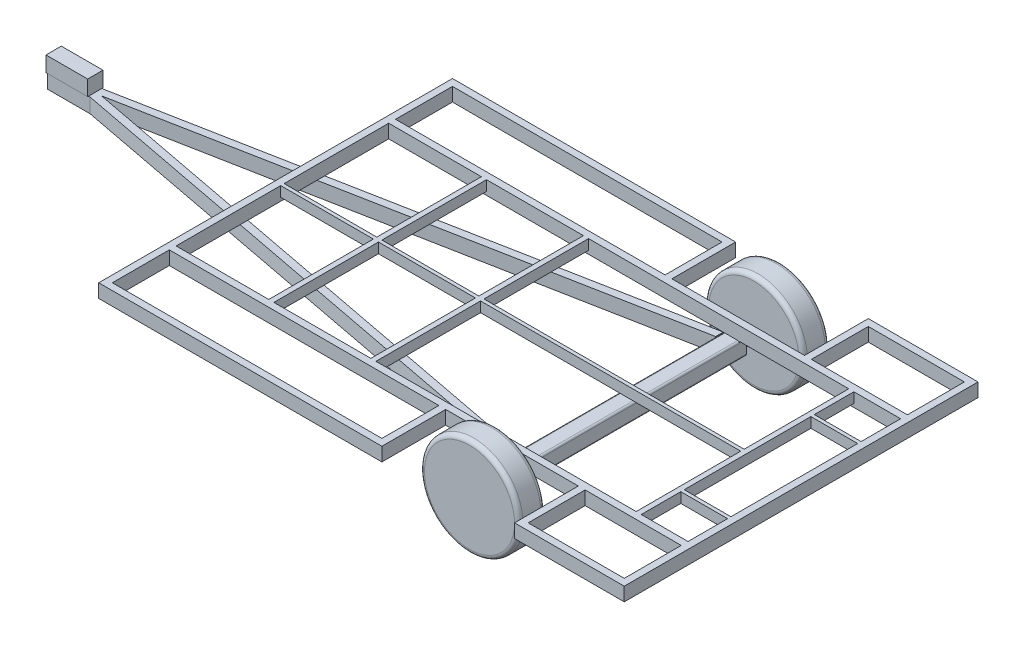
SolidWorks part; units mm, degrees
ref_plane "Plan de face" through (0, 0, 0) normal (0, 0, 1) x (1, 0, 0)
ref_plane "Plan de dessus" through (0, 0, 0) normal (0, 1, 0) x (1, 0, 0)
ref_plane "Plan de droite" through (0, 0, 0) normal (1, 0, 0) x (0, 0, -1)
sketch "Esquisse1" plane through (0, 0, 0) normal (0, 1, 0) x (1, 0, 0)
  line L1 (0, 0) -> (3090, 0)
  line L2 (0, 0) -> (0, 2080)
  line L3 (0, 2080) -> (3090, 2080)
  line L4 (3090, 0) -> (3090, 2080)
  line L5 (40, 2040) -> (3050, 2040)
  line L6 (40, 2040) -> (40, 40)
  line L7 (40, 40) -> (3050, 40)
  line L8 (3050, 2040) -> (3050, 40)
  dimension "D1" = 2080
  dimension "D2" = 3090
  dimension "D3" = 40
  dimension "D4" = 40
  dimension "D5" = 40
  dimension "D6" = 40
extrude "Boss.-Extru.1" add sketch "Esquisse1" along normal blind 80
sketch "Esquisse2" plane through (0, 0, 0) normal (0, 1, 0) x (1, 0, 0)
  line L0 (40, 2040) -> (40, 40) construction
  line L1 (40, 1665) -> (3050, 1665)
  line L2 (40, 1665) -> (40, 1705)
  line L3 (40, 1705) -> (3050, 1705)
  line L4 (3050, 1665) -> (3050, 1705)
  line L5 (3050, 40) -> (3050, 2040) construction
  line L6 (3050, 2040) -> (40, 2040) construction
  line L7 (40, 415) -> (3050, 415)
  line L8 (40, 415) -> (40, 375)
  line L9 (40, 375) -> (3050, 375)
  line L10 (3050, 415) -> (3050, 375)
  line L11 (1665, 2040) -> (1625, 2040)
  line L12 (1665, 2040) -> (1665, 1705)
  line L13 (1665, 1705) -> (1625, 1705)
  line L14 (1625, 2040) -> (1625, 1705)
  line L15 (40, 40) -> (3050, 40) construction
  line L16 (2445, 2040) -> (2485, 2040)
  line L17 (2445, 2040) -> (2445, 1705)
  line L18 (2445, 1705) -> (2485, 1705)
  line L19 (2485, 2040) -> (2485, 1705)
  line L20 (1625, 375) -> (1665, 375)
  line L21 (1625, 375) -> (1625, 40)
  line L22 (1625, 40) -> (1665, 40)
  line L23 (1665, 375) -> (1665, 40)
  line L25 (2445, 375) -> (2485, 375)
  line L26 (2445, 375) -> (2445, 40)
  line L27 (2445, 40) -> (2485, 40)
  line L28 (2485, 375) -> (2485, 40)
  dimension "D1" = 40
  dimension "D2" = 40
  dimension "D3" = 565
  dimension "D4" = 780
  dimension "D5" = 40
  dimension "D6" = 335
  dimension "D7" = 335
  dimension "D8" = 40
extrude "Boss.-Extru.7" add sketch "Esquisse2" along normal blind 80 contours L1 L4 L3 L2 | L12 L13 L14 L11 | L19 L18 L17 L16 | L23 L22 L21 L20 | L9 L10 L7 L8 | L26 L27 L28 L25
sketch "Esquisse4" plane through (0, 0, 0) normal (0, 1, 0) x (1, 0, 0)
  line L0 (40, 1050) -> (585, 1050)
  line L1 (40, 1665) -> (40, 415) construction
  line L2 (585, 1050) -> (585, 1665)
  line L3 (40, 1665) -> (3050, 1665) construction
  line L4 (585, 1665) -> (615, 1665)
  line L5 (615, 1665) -> (615, 1050)
  line L6 (615, 1050) -> (1185, 1050)
  line L7 (1185, 1050) -> (1185, 1665)
  line L8 (1185, 1665) -> (1215, 1665)
  line L9 (1215, 1665) -> (1215, 1050)
  line L10 (1215, 1050) -> (2745, 1050)
  line L11 (2745, 1050) -> (2745, 1665)
  line L12 (2745, 1665) -> (2775, 1665)
  line L13 (2775, 1665) -> (2775, 1432.5)
  line L14 (2775, 1432.5) -> (3050, 1432.5)
  line L15 (3050, 415) -> (3050, 1665) construction
  line L16 (3050, 1432.5) -> (3050, 1412.5)
  line L17 (3050, 1412.5) -> (2775, 1412.5)
  line L18 (2775, 1412.5) -> (2775, 667.5)
  line L20 (40, 1030) -> (40, 1050)
  line L21 (-422.2595, 1040) -> (3457.475, 1040) construction
  line L22 (2775, 415) -> (2775, 647.5)
  line L23 (2745, 415) -> (2775, 415)
  line L24 (2745, 1030) -> (2745, 415)
  line L25 (1215, 1030) -> (2745, 1030)
  line L26 (1215, 415) -> (1215, 1030)
  line L27 (1185, 415) -> (1215, 415)
  line L28 (1185, 1030) -> (1185, 415)
  line L29 (615, 1030) -> (1185, 1030)
  line L30 (615, 415) -> (615, 1030)
  line L31 (585, 415) -> (615, 415)
  line L32 (585, 1030) -> (585, 415)
  line L33 (40, 1030) -> (585, 1030)
  line L34 (3050, 647.5) -> (3050, 667.5)
  line L35 (3050, 667.5) -> (2775, 667.5)
  line L36 (2775, 647.5) -> (3050, 647.5)
  dimension "D2" = 30
  dimension "D3" = 30
  dimension "D4" = 30
  dimension "D5" = 20
  dimension "D6" = 275
  dimension "D7" = 665
  dimension "D8" = 545
  dimension "D9" = 570
  dimension "D10" = 745
  dimension "D11" = 615
extrude "Boss.-Extru.8" add sketch "Esquisse4" along normal blind 60 from offset 20
sketch "Esquisse5" plane through (0, 0, 0) normal (0, 1, 0) x (1, 0, 0)
  line L1 (2445, 2040) -> (1665, 2040)
  line L2 (2445, 2040) -> (2445, 2090)
  line L3 (2445, 2090) -> (1665, 2090)
  line L4 (1665, 2040) -> (1665, 2090)
  line L5 (1665, 40) -> (2445, 40)
  line L6 (1665, 40) -> (1665, -10)
  line L7 (1665, -10) -> (2445, -10)
  line L8 (2445, 40) -> (2445, -10)
  dimension "D1" = 780
  dimension "D2" = 780
  dimension "D3" = 50
  dimension "D4" = 50
extrude "Enlèv. mat.-Extru.5" cut sketch "Esquisse5" along normal through all
sketch "Esquisse6" plane through (0, 0, 0) normal (0, 1, 0) x (1, 0, 0)
  line L0 (1665, 1705) -> (2445, 1705) construction
  line L1 (2007.5, 1705) -> (2102.5, 1705)
  line L2 (2007.5, 1705) -> (2007.5, 375)
  line L3 (2007.5, 375) -> (2102.5, 375)
  line L4 (2102.5, 1705) -> (2102.5, 375)
  line L5 (1665, 375) -> (2445, 375) construction
  dimension "D1" = 95
  dimension "D2" = 342.5
extrude "Boss.-Extru.9" add sketch "Esquisse6" against normal blind 95
fillet "Congé1" radius 10 4 edges at (2007.5, -95, -1040) (2102.5, -95, -1040) (2102.5, 0, -1040) (2007.5, 0, -1040)
sketch "Esquisse8" plane through (0, 0, -375) normal (0, 0, 1) x (1, 0, 0)
  line L0 (2017.5, -95) -> (2092.5, -95) construction
  circle A0 centre (2055, -47.5) radius 35
  dimension "D3" = 70
  dimension "D1" = 47.5
  dimension "D2" = 47.5
extrude "Boss.-Extru.10" add sketch "Esquisse8" along normal blind 95 and the other way blind 1422
sketch "Esquisse9" plane through (0, 0, -280) normal (0, 0, 1) x (1, 0, 0)
  circle A0 centre (2055, -47.5) radius 290
  dimension "D1" = 580
extrude "Boss.-Extru.11" add sketch "Esquisse9" along normal blind 155
sketch "Esquisse10" plane through (0, 0, -1797) normal (0, 0, -1) x (-1, 0, 0)
  circle A0 centre (-2055, -47.5) radius 290
  dimension "D1" = 580
extrude "Boss.-Extru.12" add sketch "Esquisse10" along normal blind 155
fillet "Congé2" radius 25 4 edges at (2345, -47.5, -125) (2345, -47.5, -280) (1765, -47.5, -1797) (1765, -47.5, -1952)
sketch "Esquisse11" plane through (0, 0, 0) normal (0, -1, 0) x (1, 0, 0)
  line L0 (-1300, -1080) -> (-1050, -1080)
  line L2 (-1300, -1000) -> (-1050, -1000)
  line L3 (-1300, -1000) -> (-1300, -1080)
  line L4 (-1050, -1000) -> (2007.5, -415)
  line L5 (2007.5, -415) -> (2007.5, -460)
  line L6 (2007.5, -460) -> (-1021.2543, -1039.5)
  line L7 (-1021.2543, -1039.5) -> (-1021.2543, -1040.5)
  line L8 (-1021.2543, -1040.5) -> (2007.5, -1620)
  line L9 (2007.5, -1705) -> (2007.5, -375) construction
  line L10 (2007.5, -1620) -> (2007.5, -1665)
  line L11 (2007.5, -1665) -> (-1050, -1080)
  line L12 (0, -2080) -> (0, 0) construction
  dimension "D1" = 1300
  dimension "D2" = 80
  dimension "D3" = 250
  dimension "D4" = 45
  dimension "D5" = 45
  dimension "D6" = 1
  dimension "D7" = 1000
  dimension "D8" = 250
extrude "Boss.-Extru.26" add sketch "Esquisse11" along normal blind 85 separate body
sketch "Esquisse12" plane through (0, 0, 0) normal (0, 1, 0) x (1, 0, 0)
  line L1 (-1305, 1085) -> (-1060, 1085)
  line L2 (-1305, 1085) -> (-1305, 995)
  line L3 (-1305, 995) -> (-1060, 995)
  line L4 (-1060, 1085) -> (-1060, 995)
  dimension "D1" = 90
  dimension "D2" = 5
  dimension "D3" = 5
  dimension "D4" = 245
extrude "Boss.-Extru.27" add sketch "Esquisse12" along normal blind 90
